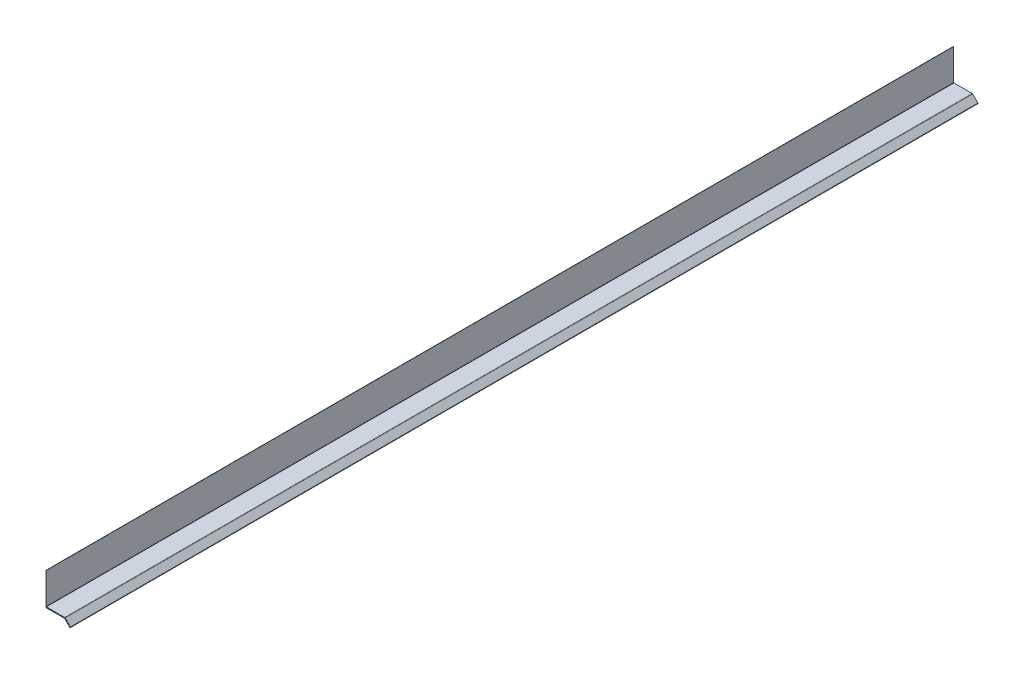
SolidWorks part; units mm, degrees
ref_plane "Front" through (0, 0, 0) normal (0, 0, 1) x (1, 0, 0)
ref_plane "Top" through (0, 0, 0) normal (0, 1, 0) x (1, 0, 0)
ref_plane "Right" through (0, 0, 0) normal (1, 0, 0) x (0, 0, -1)
sketch "Sketch1" plane through (0, 0, 0) normal (0, 0, 1) x (1, 0, 0)
  line L0 (0, 1) -> (0, 69.85)
  line L1 (1, 0) -> (41.275, 0)
  line L2 (41.9934, -0.2976) -> (53.3628, -11.667)
  line L3 (41.0712, -1) -> (0.3631, -1)
  line L4 (52.6557, -12.3741) -> (41.4304, -1.1488)
  arc A0 (53.3628, -11.667) -> (52.6557, -12.3741) centre (53.0093, -12.0206) cw
  arc A1 (41.0712, -1) -> (41.4304, -1.1488) centre (41.0712, -1.508) cw
  arc A2 (41.9934, -0.2976) -> (41.275, 0) centre (41.275, -1.016) ccw
  arc A3 (0, 1) -> (1, 0) centre (1, 1) ccw
  point P18 (0, 0)
  dimension "D5" = 1.016
  dimension "D3" = 1
  dimension "D2" = 0.508
  dimension "D1" = 69.85
  dimension "D4" = 225
  dimension "D6" = 1
  dimension "D7" = 41.275
  dimension "D8" = 15.875
extrude "Extrude-Thin1" add sketch "Sketch1" along normal blind 2000 thin
